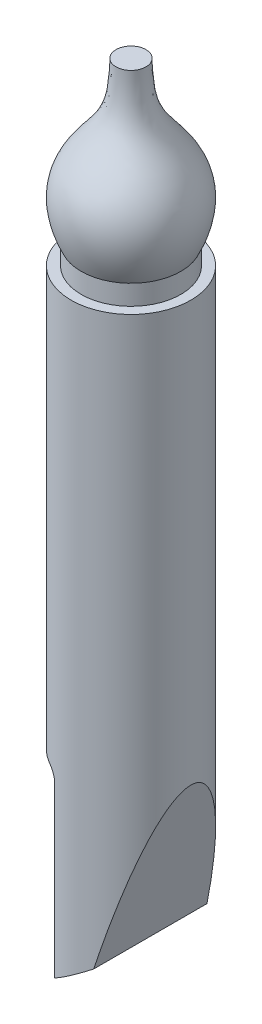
SolidWorks part; units mm, degrees
ref_plane "Спереди" through (0, 0, 0) normal (0, 0, 1) x (1, 0, 0)
ref_plane "Сверху" through (0, 0, 0) normal (0, 1, 0) x (1, 0, 0)
ref_plane "Справа" through (0, 0, 0) normal (1, 0, 0) x (0, 0, -1)
sketch "Эскиз1" plane through (0, 0, 0) normal (0, 0, 1) x (1, 0, 0)
  line L0 (0, 0) -> (3, 0)
  line L1 (3, 0) -> (3, 30)
  line L2 (3, 30) -> (2.5, 30)
  line L3 (0, 39) -> (0, 0)
  line L4 (2.5, 30) -> (2.5, 31)
  line L5 (0.75, 39) -> (0, 39)
  line L6 (0.75, 36.8304) -> (0.75, 39.5097) construction
  spline S0 degree 3 poles (0.75, 39) (0.75, 36.9949) (1.623, 35.8717) (3.6222, 33.3621) (2.5, 31) knots 0 0 0 0 0.491714 1 1 1 1
  dimension "D1" = 3
  dimension "D2" = 30
  dimension "D3" = 0.75
  dimension "D4" = 9
  dimension "D5" = 1
  dimension "D6" = 0.5
revolve "Повернуть1" add sketch "Эскиз1" angle 360 about L3
sketch "Эскиз2" plane through (0, 0, 0) normal (0, 0, 1) x (1, 0, 0)
  line L0 (-1, 8.5) -> (-1, 0)
  line L1 (-3, 0) -> (3, 0) construction
  line L2 (3, 8.9569) -> (4.3765, 8.9569)
  line L3 (-1.5, 9) -> (-3, 9)
  line L4 (4.3765, 8.9569) -> (4.3765, -1.1476)
  line L5 (-3, 30) -> (-3, 0) construction
  line L6 (-1, 0) -> (0.9695, 1.3791)
  line L7 (4.3765, -1.1476) -> (-4.0437, -1.1476)
  line L8 (3, 0) -> (3, 30) construction
  line L9 (0.6, 7.0053) -> (0.6, -3.1536) construction
  line L10 (0.9695, 1.3791) -> (3, 8.9569)
  line L11 (-4.0437, -1.1476) -> (-4.0437, 9)
  line L12 (-4.0437, 9) -> (-3, 9)
  arc A0 (-1, 8.5) -> (-1.5, 9) centre (-1.5, 8.5) ccw
  point P2 (0.6, 0)
  point P12 (-1, 9)
  dimension "D6" = 15
  dimension "D3" = 0.5
  dimension "D1" = 1
  dimension "D2" = 9
  dimension "D4" = 55
  dimension "D5" = 0.6
extrude "Вырез-Вытянуть1" cut sketch "Эскиз2" against normal through all and the other way through all
